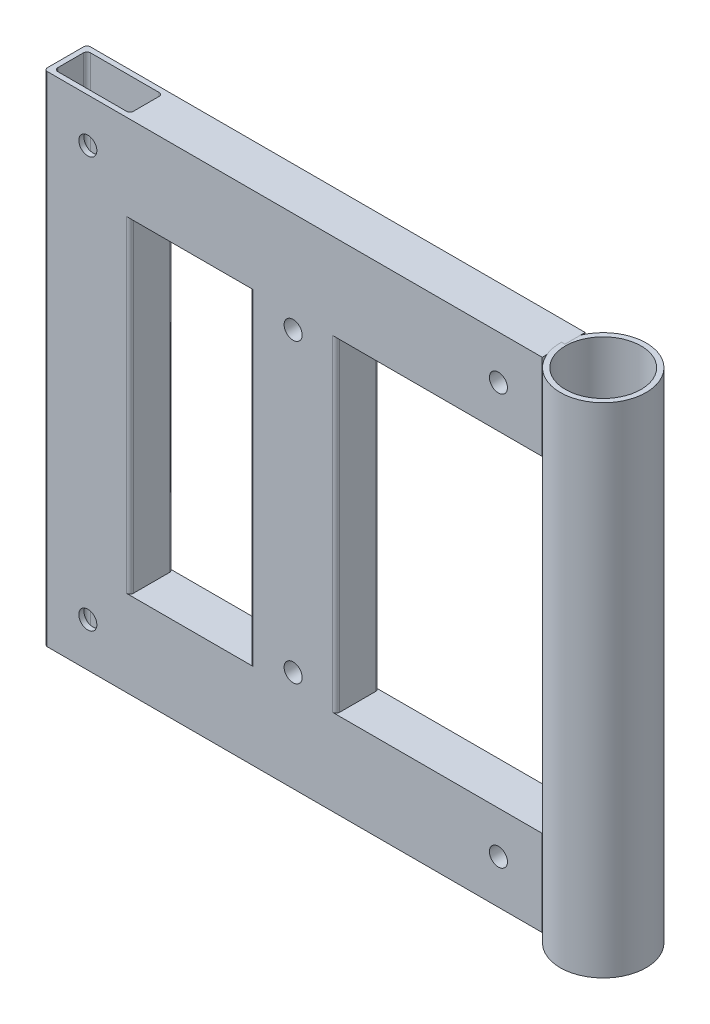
SolidWorks part; units mm, degrees
ref_plane "Face" through (0, 0, 0) normal (0, 0, 1) x (1, 0, 0)
ref_plane "Dessus" through (0, 0, 0) normal (0, 1, 0) x (1, 0, 0)
ref_plane "Droite" through (0, 0, 0) normal (1, 0, 0) x (0, 0, -1)
sketch "Esquisse1" plane through (0, 0, 0) normal (0, 0, 1) x (1, 0, 0)
  line L0 (120, -50) -> (120, -240)
  line L1 (0, 0) -> (290, 0)
  line L2 (0, 0) -> (0, -290)
  line L3 (0, -290) -> (290, -290)
  line L4 (290, 0) -> (290, -290)
  line L5 (50, -50) -> (120, -50)
  line L6 (50, -50) -> (50, -240)
  line L7 (50, -240) -> (120, -240)
  line L8 (240, -50) -> (240, -240)
  line L9 (170, -50) -> (170, -240)
  line L10 (170, -50) -> (240, -50)
  line L11 (170, -240) -> (240, -240)
  line L12 (264.5, -264.5) -> (25.5, -264.5) construction
  line L13 (145, 0) -> (145, -302.2699) construction
  circle A0 centre (264.5, -25.5) radius 5.25
  circle A1 centre (25.5, -25.5) radius 5.25
  circle A2 centre (264.5, -264.5) radius 5.25
  circle A3 centre (25.5, -264.5) radius 5.25
  circle A4 centre (145, -58.6754) radius 5.25
  circle A5 centre (145, -231.3246) radius 5.25
  dimension "D10" = 25.5
  dimension "D11" = 10.5
  dimension "D13" = 10.5
  dimension "D14" = 10.5
  dimension "D15" = 25.5
  dimension "D16" = 25.5
  dimension "D17" = 10.5
  dimension "D18" = 25.5
  dimension "D19" = 25.5
  dimension "D20" = 10.5
  dimension "D21" = 10.5
  dimension "D22" = 238
  dimension "D23" = 238
  dimension "D24" = 238
  dimension "D25" = 238
  dimension "D1" = 290
  dimension "D2" = 290
  dimension "D3" = 50
  dimension "D4" = 50
  dimension "D5" = 50
  dimension "D6" = 50
  dimension "D7" = 50
  dimension "D8" = 120
  dimension "D9" = 25.5
  dimension "D12" = 25.5
extrude "Extrusion1" add sketch "Esquisse1" along normal blind 25
fillet "Congé2" radius 2 9 edges at (0, -145, 25) (50, -145, 25) (120, -145, 25) (170, -145, 25) (240, -145, 25) (0, -145, 0) (50, -145, 0) (120, -145, 0) (170, -145, 0)
sketch "Esquisse2" plane through (0, 0, 0) normal (0, 1, 0) x (1, 0, 0)
  line L0 (2, -25) -> (290, -25) construction
  line L1 (5, -3) -> (45, -3)
  line L2 (3, -5) -> (3, -20)
  line L3 (5, -22) -> (45, -22)
  line L4 (47, -5) -> (47, -20)
  line L9 (0, -23) -> (0, -2) construction
  arc A0 (47, -20) -> (45, -22) centre (45, -20) cw
  arc A1 (45, -3) -> (47, -5) centre (45, -5) cw
  arc A2 (3, -5) -> (5, -3) centre (5, -5) cw
  arc A3 (3, -20) -> (5, -22) centre (5, -20) ccw
  dimension "D1" = 2
  dimension "D3" = 44
  dimension "D5" = 19
  dimension "D6" = 3
  dimension "D8" = 3
extrude "Enlèv. mat.-Extru.1" cut sketch "Esquisse2" against normal through all
sketch "Esquisse4" plane through (0, 0, 25) normal (0, 0, 1) x (1, 0, 0)
  line L0 (242, -50) -> (168, -50) construction
  line L1 (237.0312, -50) -> (290, -50)
  line L2 (237.0312, -50) -> (237.0312, -240)
  line L3 (237.0312, -240) -> (290, -240)
  line L4 (290, -50) -> (290, -240)
  line L5 (290, -290) -> (290, 0) construction
extrude "Enlèv. mat.-Extru.3" cut sketch "Esquisse4" against normal through all
sketch "Esquisse5" plane through (0, 0, 0) normal (0, 1, 0) x (1, 0, 0)
  line L0 (290, -25) -> (290, 0) construction
  line L1 (290, -12.5) -> (336.287, -12.5) construction
  circle A0 centre (313, -12.5) radius 25
  dimension "D1" = 50
  dimension "D2" = 23
extrude "Extrusion2" add sketch "Esquisse5" against normal up to vertex (290 mm away) separate body
sketch "Esquisse6" plane through (0, 0, 0) normal (0, 1, 0) x (1, 0, 0)
  circle A0 centre (313, -12.5) radius 22
extrude "Enlèv. mat.-Extru.4" cut sketch "Esquisse6" against normal through all
